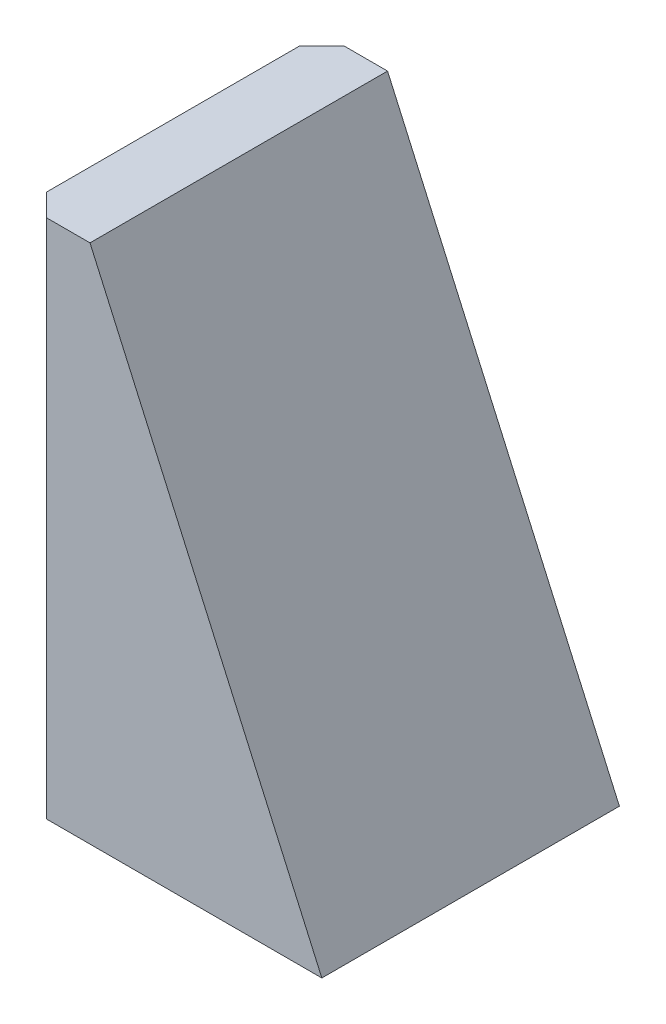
SolidWorks part; units mm, degrees
ref_plane "前视基准面" through (0, 0, 0) normal (0, 0, 1) x (1, 0, 0)
ref_plane "上视基准面" through (0, 0, 0) normal (0, 1, 0) x (1, 0, 0)
ref_plane "右视基准面" through (0, 0, 0) normal (1, 0, 0) x (0, 0, -1)
other "Configuration Table"
sketch "草图1" plane through (0, 0, 0) normal (0, 0, 1) x (1, 0, 0)
  line L0 (0, 0) -> (4, 0)
  line L1 (4, 0) -> (0.8834, 7)
  line L2 (0.8834, 7) -> (0, 7)
  line L3 (0, 7) -> (0, 0)
  dimension "D1" = 4
  dimension "D2" = 7
  dimension "D3" = 66
extrude "凸台-拉伸1" add sketch "草图1" along normal blind 4
chamfer "倒角1" distance 0.3 angle 45 2 edges at (0, 3.5, 0) (0, 3.5, 4)
